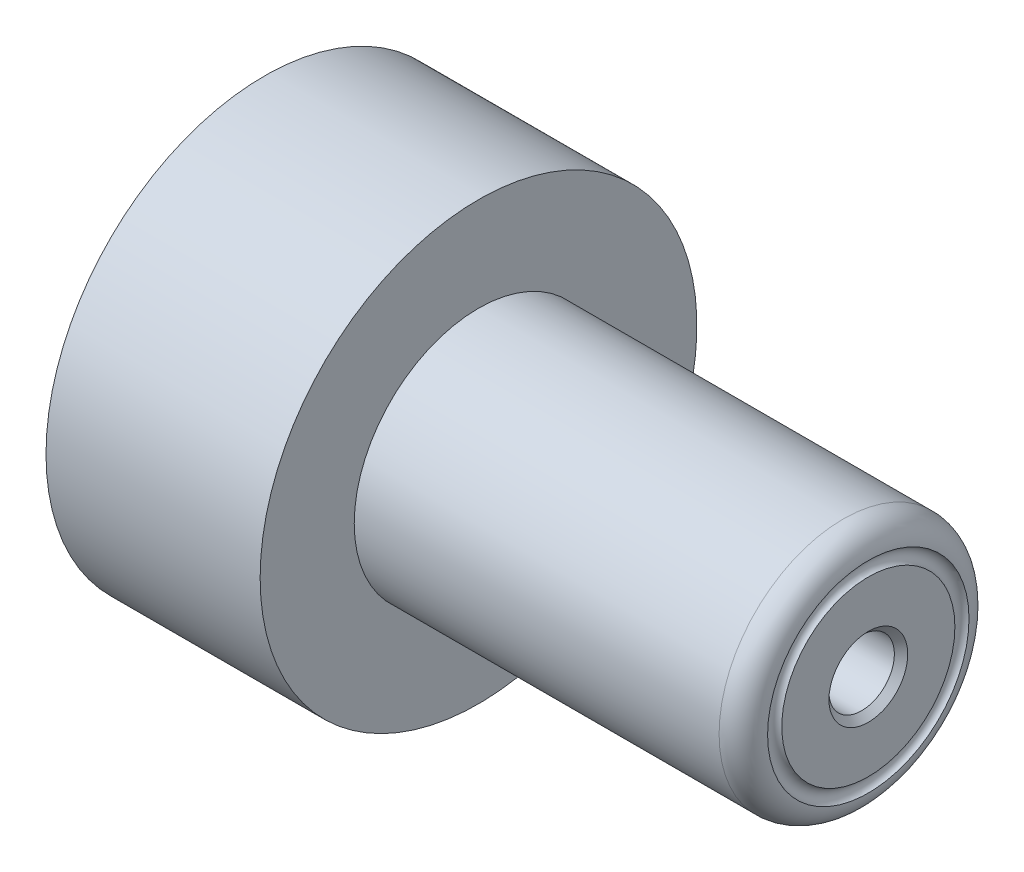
SolidWorks part; units mm, degrees
ref_plane "Front Plane" through (0, 0, 0) normal (0, 0, 1) x (1, 0, 0)
ref_plane "Top Plane" through (0, 0, 0) normal (0, 1, 0) x (1, 0, 0)
ref_plane "Right Plane" through (0, 0, 0) normal (1, 0, 0) x (0, 0, -1)
sketch "Sketch1" plane through (0, 0, 0) normal (0, 0, 1) x (1, 0, 0)
  line L0 (0, 0) -> (102.3864, 0) construction
  line L1 (0, 3.9751) -> (0, 11.1125)
  line L2 (0, 11.1125) -> (10.8966, 11.1125)
  line L3 (10.8966, 11.1125) -> (10.8966, 6.3246)
  line L4 (10.8966, 6.3246) -> (29.464, 6.3246)
  line L5 (30.734, 5.0546) -> (30.734, 0)
  line L6 (30.734, 0) -> (21.8948, 0)
  line L7 (0, 3.9751) -> (21.8948, 3.9751)
  line L8 (21.8948, 3.9751) -> (21.8948, 0)
  arc A0 (30.734, 5.0546) -> (29.464, 6.3246) centre (29.464, 5.0546) ccw
  dimension "D5" = 1.27
  dimension "D1" = 10.8966
  dimension "D2" = 22.225
  dimension "D3" = 21.8948
  dimension "D4" = 7.9502
  dimension "D6" = 30.734
  dimension "D7" = 12.6492
revolve "Revolve1" add sketch "Sketch1" angle 360 about L0
sketch "Sketch2" plane through (0, 0, 0) normal (-1, 0, 0) x (0, 0, 1)
  line L0 (0, 0) -> (0, 9.7644) construction
  circle A0 centre (-6.7437, 0) radius 1.2065
  circle A1 centre (6.7437, 0) radius 1.2065
  dimension "D2" = 2.413
  dimension "D1" = 13.4874
extrude "Cut-Extrude1" cut sketch "Sketch2" against normal blind 2.54
sketch "Sketch3" plane through (30.734, 0, 0) normal (1, 0, 0) x (0, 0, -1)
  circle A0 centre (0, 0) radius 1.665
  dimension "D1" = 3.33
extrude "Cut-Extrude2" cut sketch "Sketch3" against normal through all
chamfer "Chamfer1" distance 0.34 angle 45 1 edges at (30.734, 0, -1.665)
sketch "Sketch4" plane through (0, 0, 0) normal (0, 0, 1) x (1, 0, 0)
  line L0 (0, 0) -> (35.115, 0) construction
  line L1 (0, 11.1125) -> (0, -11.1125) construction
  circle A0 centre (30.857, 4.765) radius 0.381
  dimension "D1" = 0.762
  dimension "D3" = 30.857
  dimension "D2" = 4.765
revolve "Cut-Revolve1" cut sketch "Sketch4" angle 360 about L0
